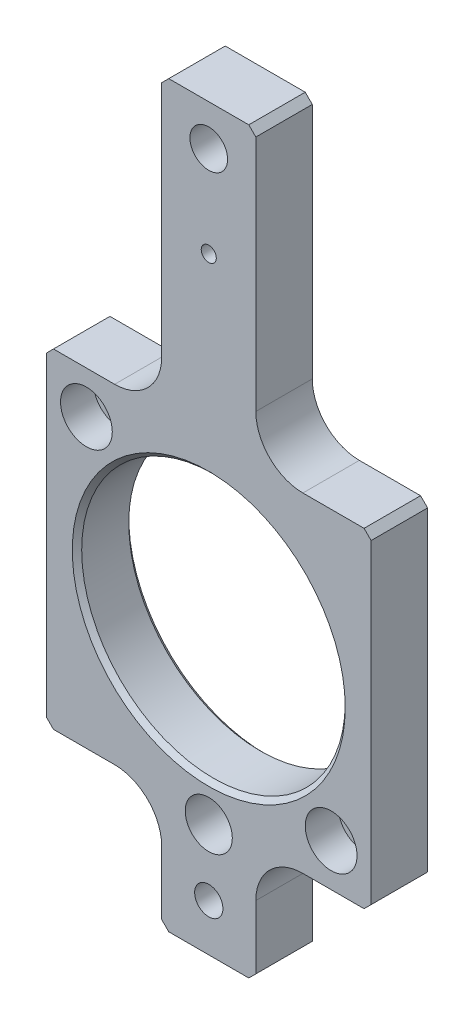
SolidWorks part; units mm, degrees
ref_plane "Plan1" through (0, 0, 0) normal (0, 0, 1) x (1, 0, 0)
ref_plane "Plan2" through (0, 0, 0) normal (0, 1, 0) x (1, 0, 0)
ref_plane "Plan3" through (0, 0, 0) normal (1, 0, 0) x (0, 0, -1)
sketch "Esquisse1" plane through (0, 0, 0) normal (0, 0, 1) x (1, 0, 0)
  line L0 (0, 0) -> (20, 0)
  line L1 (20, 0) -> (20, 15)
  line L2 (30, 25) -> (44.5, 25)
  line L3 (44.5, 25) -> (44.5, 95)
  line L4 (44.5, 95) -> (30, 95)
  line L5 (20, 105) -> (20, 157)
  line L6 (20, 157) -> (0, 157)
  line L7 (0, 157) -> (0, 105)
  line L8 (-10, 95) -> (-24.5, 95)
  line L9 (-24.5, 95) -> (-24.5, 25)
  line L10 (-24.5, 25) -> (-10, 25)
  line L11 (0, 15) -> (0, 0)
  arc A0 (20, 105) -> (30, 95) centre (30, 105) ccw
  arc A1 (-10, 95) -> (0, 105) centre (-10, 105) ccw
  arc A2 (0, 15) -> (-10, 25) centre (-10, 15) ccw
  arc A3 (30, 25) -> (20, 15) centre (30, 15) ccw
  dimension "D6" = 10
  dimension "D1" = 70
  dimension "D2" = 62
  dimension "D3" = 157
  dimension "D4" = 69
  dimension "D5" = 20
extrude "Base-Extrusion" add sketch "Esquisse1" along normal blind 12
other "Perçage2" parameters "D1"=12
sketch "Esquisse3" plane through (0, 0, 12) normal (0, 0, 1) x (1, 0, 0)
  line L0 (20, 157) -> (0, 157) construction
  line L1 (0, 157) -> (0, 105) construction
  circle A0 centre (10, 60) radius 28
  dimension "D1" = 56
  dimension "D2" = 97
  dimension "D3" = 10
chamfer "Chanfrein1" distance 1 angle 45
other "Perçage3" parameters "D1"=12
sketch "Esquisse4" plane through (0, 0, 12) normal (0, 0, 1) x (1, 0, 0)
  circle A0 centre (-16, 86) radius 3.2
  dimension "D1" = 6.4
  dimension "D2" = 26
  dimension "D3" = 26
other "Perçage4" parameters "D1"=7
sketch "Esquisse5" plane through (0, 0, 12) normal (0, 0, 1) x (1, 0, 0)
  circle A0 centre (-16, 86) radius 5.5
  circle A1 centre (-16, 86) radius 3.2 construction
  dimension "D1" = 11
other "Perçage5" parameters "D1"=12
sketch "Esquisse6" plane through (0, 0, 12) normal (0, 0, 1) x (1, 0, 0)
  circle A0 centre (36, 34) radius 3.2
  dimension "D1" = 6.4
  dimension "D2" = 26
  dimension "D3" = 26
other "Perçage6" parameters "D1"=7
sketch "Esquisse7" plane through (0, 0, 12) normal (0, 0, 1) x (1, 0, 0)
  circle A0 centre (36, 34) radius 5.5
  circle A1 centre (36, 34) radius 3.2 construction
  dimension "D1" = 11
chamfer "Chanfrein2" distance 1.5 angle 45
other "Perçage7" parameters "D1"=12
sketch "Esquisse8" plane through (0, 0, 12) normal (0, 0, 1) x (1, 0, 0)
  circle A0 centre (10, 148.37) radius 4
  dimension "D1" = 8
  dimension "D2" = 88.37
other "Perçage8" parameters "D1"=12
sketch "Esquisse9" plane through (0, 0, 12) normal (0, 0, 1) x (1, 0, 0)
  circle A0 centre (10, 24) radius 5
  dimension "D1" = 10
  dimension "D2" = 36
other "Perçage9" parameters "D1"=12
sketch "Esquisse10" plane through (0, 0, 12) normal (0, 0, 1) x (1, 0, 0)
  circle A0 centre (10, 10) radius 3
  dimension "D1" = 6
  dimension "D2" = 50
other "Perçage10" parameters "D1"=12
sketch "Esquisse11" plane through (0, 0, 12) normal (0, 0, 1) x (1, 0, 0)
  circle A0 centre (10, 129) radius 1.6
  dimension "D1" = 3.2
  dimension "D2" = 69
sketch "Esquisse12" plane through (0, 0, 0) normal (0, -1, 0) x (1, 0, 0)
  line L0 (10, 1) -> (10, 11) construction
  line L1 (1.5, 0) -> (18.5, 0) construction
  circle A0 centre (10, 6) radius 1.6
  dimension "D1" = 3.2
  dimension "D2" = 6
extrude "Enlèv. mat.-Extru.1" cut sketch "Esquisse12" against normal blind 10
